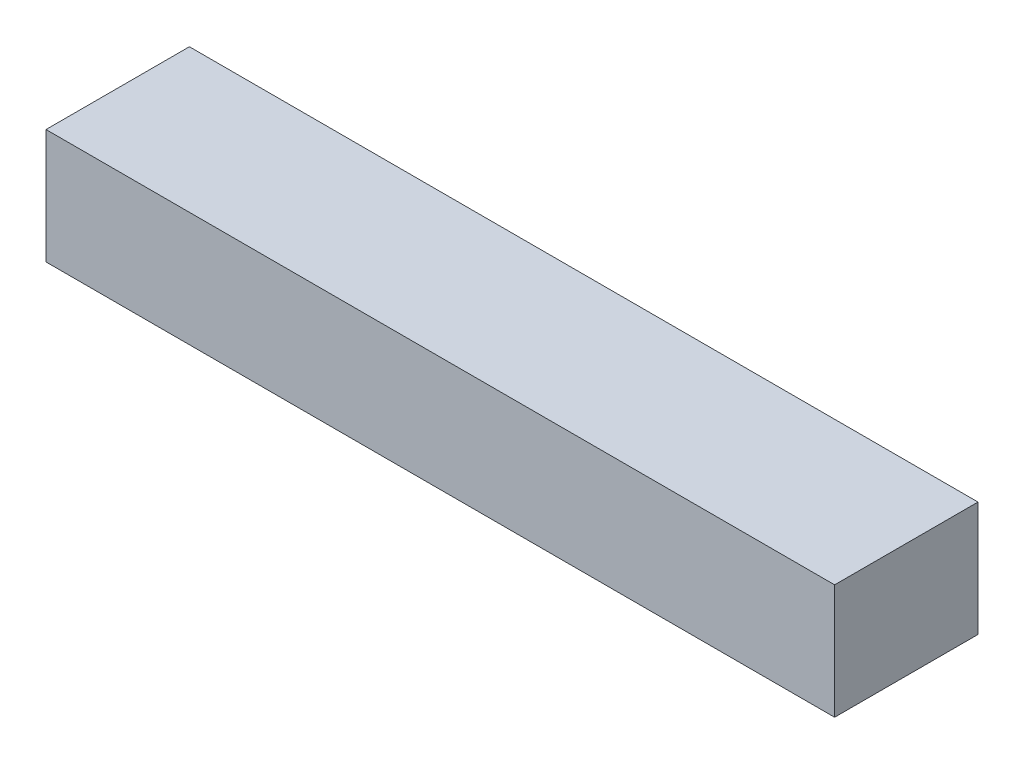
SolidWorks part; units mm, degrees
ref_plane "Front Plane" through (0, 0, 0) normal (0, 0, 1) x (1, 0, 0)
ref_plane "Top Plane" through (0, 0, 0) normal (0, 1, 0) x (1, 0, 0)
ref_plane "Right Plane" through (0, 0, 0) normal (1, 0, 0) x (0, 0, -1)
sketch "Sketch1" plane through (0, 0, 0) normal (0, 0, 1) x (1, 0, 0)
  line L1 (-27.5, 4) -> (27.5, 4)
  line L2 (-27.5, 4) -> (-27.5, -4)
  line L3 (-27.5, -4) -> (27.5, -4)
  line L4 (27.5, 4) -> (27.5, -4)
  line L5 (-27.5, 4) -> (27.5, -4) construction
  line L6 (-27.5, -4) -> (27.5, 4) construction
  point P0 (0, 0)
  dimension "D1" = 8
  dimension "D2" = 55
extrude "Boss-Extrude1" add sketch "Sketch1" along normal blind 10
